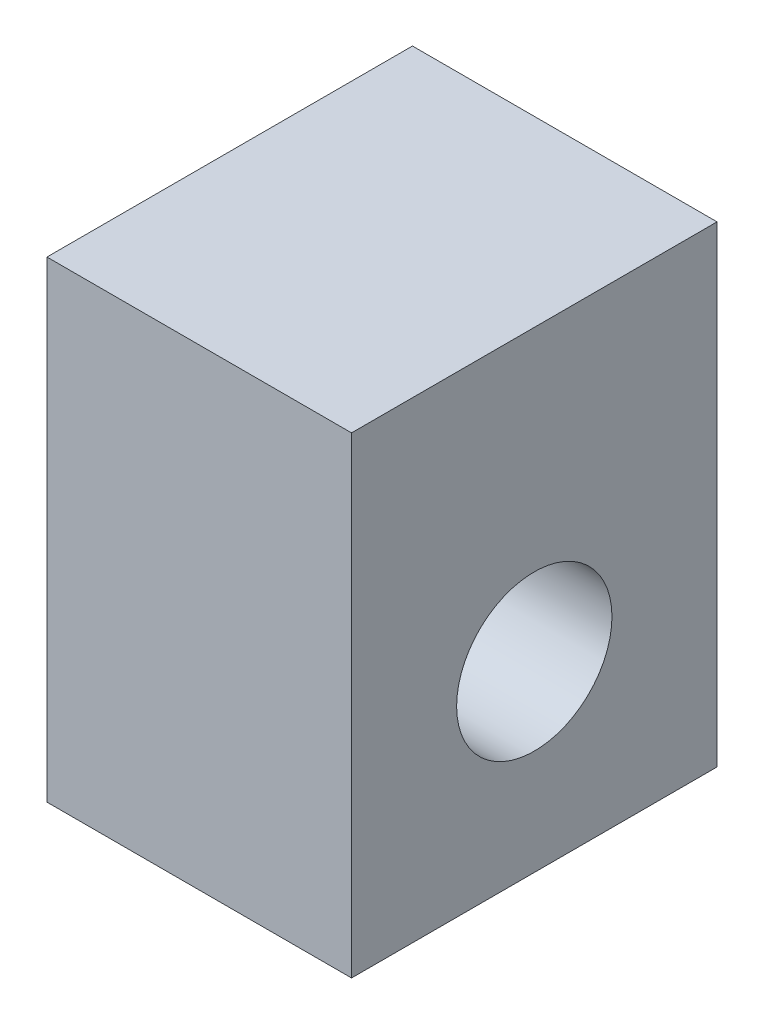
SolidWorks part; units mm, degrees
ref_plane "前视基准面" through (0, 0, 0) normal (0, 0, 1) x (1, 0, 0)
ref_plane "上视基准面" through (0, 0, 0) normal (0, 1, 0) x (1, 0, 0)
ref_plane "右视基准面" through (0, 0, 0) normal (1, 0, 0) x (0, 0, -1)
other "Configuration Table"
sketch "草图1" plane through (0, 0, 0) normal (0, 0, 1) x (1, 0, 0)
  line L1 (-10, -19) -> (10, -19)
  line L2 (-10, -19) -> (-10, 19)
  line L3 (-10, 19) -> (10, 19)
  line L4 (10, -19) -> (10, 19)
  line L5 (-10, -19) -> (10, 19) construction
  line L6 (-10, 19) -> (10, -19) construction
  point P0 (0, 0)
  dimension "D1" = 10
  dimension "D2" = 19
extrude "Screw_Bearing_Block" add sketch "草图1" against normal mid plane 24
sketch "草图2" plane through (0, 0, 0) normal (1, 0, 0) x (0, 0, -1)
  circle A0 centre (0, 0) radius 4.2
  dimension "D1" = 8.4
extrude "Screw_Bore_D8p4" cut sketch "草图2" against normal mid plane 50
sketch "草图3" plane through (0, 0, 0) normal (0, 0, 1) x (1, 0, 0)
  line L1 (-30, -48) -> (30, -48)
  line L2 (-30, -48) -> (-30, -12)
  line L3 (-30, -12) -> (30, -12)
  line L4 (30, -48) -> (30, -12)
  line L5 (-30, -48) -> (30, -12) construction
  line L6 (-30, -12) -> (30, -48) construction
  point P0 (0, -30)
  dimension "D1" = 30
  dimension "D2" = 12
  dimension "D3" = 30
extrude "Bearing_Foot_At_Yminus12" cut sketch "草图3" against normal mid plane 100
sketch "草图4" plane through (0, 0, 0) normal (1, 0, 0) x (0, 0, -1)
  circle A0 centre (0, 0) radius 5.1
  dimension "D1" = 10.2
extrude "Bearing_Insert_Seat_D10p2" cut sketch "草图4" against normal mid plane 50
